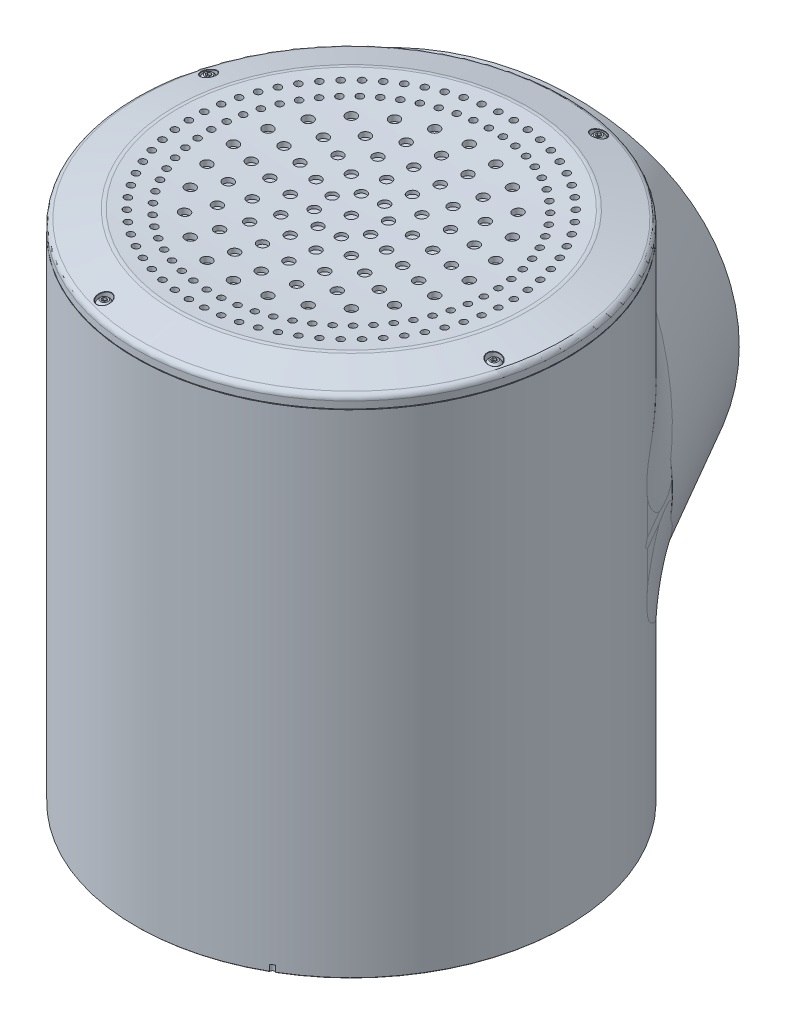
SolidWorks part; units mm, degrees
other "<4.0.07.2008582>-<输入1>"
other "<4.0.07.2008582>-<输入1>"
other "<4.0.07.2008582>-<输入1>"
other "<4.0.07.2008582>-<输入1>"
ref_plane "前视基准面" through (0, 0, 0) normal (0, 0, 1) x (1, 0, 0)
ref_plane "上视基准面" through (0, 0, 0) normal (0, 1, 0) x (1, 0, 0)
ref_plane "右视基准面" through (0, 0, 0) normal (1, 0, 0) x (0, 0, -1)
imported_body "FR20-V6.0-2-1-1-solid1"
imported_body "FR20-V6.0-2-1-1-solid2"
imported_body "FR20-V6.0-40关节后盖-1-solid1"
sketch "草图2" plane through (0, 311.2, 0) normal (0, 1, 0) x (1, 0, 0)
  circle A0 centre (0, 0) radius 93.1063
extrude "凸台-拉伸1" add sketch "草图2" along normal up to surface (10.9 mm away) contours A0
sketch "草图4" plane through (0, 326.5, 0) normal (0, 1, 0) x (1, 0, 0)
  circle A0 centre (0, 0) radius 75.45 construction
  circle A1 centre (0, 0) radius 76.25
  circle A2 centre (0, 0) radius 76.25
  circle A3 centre (0, 0) radius 75.45
  dimension "D1" = 0
extrude "凸台-拉伸2" add sketch "草图4" along normal up to surface (0.4744 mm away)
sketch "草图5" plane through (0, 322.1, 0) normal (0, 1, 0) x (1, 0, 0)
  circle A0 centre (0, 0) radius 74.3701
  circle A1 centre (0, 0) radius 63.0968
extrude "凸台-拉伸3" add sketch "草图5" along normal up to surface (4.7489 mm away)
sketch "草图6" plane through (0, 322.1, 0) normal (0, 1, 0) x (1, 0, 0)
  circle A0 centre (0, 0) radius 56.25
  circle A1 centre (0, 0) radius 45.75
extrude "凸台-拉伸4" add sketch "草图6" along normal up to surface (3.7003 mm away)
sketch "草图7" plane through (0, 322.1, 0) normal (0, 1, 0) x (1, 0, 0)
  circle A0 centre (0, 0) radius 32.7894
  circle A1 centre (0, 0) radius 21.1102
extrude "凸台-拉伸5" add sketch "草图7" along normal up to surface (2.7756 mm away)
sketch "草图8" plane through (0, 322.1, 0) normal (0, 1, 0) x (1, 0, 0)
  circle A0 centre (0, 0) radius 8.6373
extrude "凸台-拉伸6" add sketch "草图8" along normal up to surface (2.333 mm away)
sketch "草图10" plane through (0, 322.1, 0) normal (0, 1, 0) x (1, 0, 0)
  circle A0 centre (42.4264, -42.4264) radius 2.25 construction
  circle A7 centre (12.7279, -12.7279) radius 2.25 construction
  circle A8 centre (8.4853, -8.4853) radius 2.25 construction
  circle A12 centre (-8.4853, 8.4853) radius 2.25 construction
  circle A13 centre (-12.7279, 12.7279) radius 2.25 construction
  circle A16 centre (-25.4558, 25.4558) radius 2.25 construction
  circle A17 centre (-29.6985, 29.6985) radius 2.25 construction
  circle A20 centre (-42.4264, 42.4264) radius 2.25 construction
  circle A22 centre (42.4264, -42.4264) radius 2.25
  circle A29 centre (12.7279, -12.7279) radius 2.25
  circle A30 centre (8.4853, -8.4853) radius 2.25
  circle A34 centre (-8.4853, 8.4853) radius 2.25
  circle A35 centre (-12.7279, 12.7279) radius 2.25
  circle A38 centre (-25.4558, 25.4558) radius 2.25
  circle A39 centre (-29.6985, 29.6985) radius 2.25
  circle A42 centre (-42.4264, 42.4264) radius 2.25
  circle A44 centre (29.6985, -29.6985) radius 2.25 construction
  circle A45 centre (25.4558, -25.4558) radius 2.25 construction
  circle A46 centre (29.6985, -29.6985) radius 2.25
  circle A47 centre (25.4558, -25.4558) radius 2.25
extrude "凸台-拉伸7" add sketch "草图10" along normal up to surface (3.1418 mm away)
pattern_circular "阵列(圆周)1" count 6 over 360 about axis through (0, 327.6, 0) along (0, -1, 0) of "凸台-拉伸7"
inserted part "4.0.07.2008582"
move or copy body "实体-移动/复制2" placed by mates yes
inserted part "4.0.07.20085822"
move or copy body "实体-移动/复制4" placed by mates yes
inserted part "4.0.07.20085823"
move or copy body "实体-移动/复制6" placed by mates yes
inserted part "4.0.07.20085824"
move or copy body "实体-移动/复制8" placed by mates yes
sketch "草图15" plane through (0, 322.1, 0) normal (0, 1, 0) x (1, 0, 0)
  circle A0 centre (0, 0) radius 67.3214
extrude "凸台-拉伸8" add sketch "草图15" along normal up to surface (4.3063 mm away)
ref_plane "基准面5" through (0, 323.1, 0) normal (0, -1, 0) x (-1, 0, 0)
sketch "草图16" plane through (0, 323.1, 0) normal (0, -1, 0) x (-1, 0, 0)
  circle A0 centre (-1.6658, 69.9802) radius 1.5
  circle A1 centre (4.9937, 69.8216) radius 1.5
  circle A2 centre (11.6081, 69.0308) radius 1.5
  circle A3 centre (18.1173, 67.6148) radius 1.5
  circle A4 centre (24.4625, 65.5865) radius 1.5
  circle A5 centre (30.5861, 62.9642) radius 1.5
  circle A6 centre (36.4327, 59.7717) radius 1.5
  circle A7 centre (41.9494, 56.0379) radius 1.5
  circle A8 centre (47.0862, 51.7966) radius 1.5
  circle A9 centre (51.7966, 47.0862) radius 1.5
  circle A10 centre (56.0379, 41.9494) radius 1.5
  circle A11 centre (59.7717, 36.4327) radius 1.5
  circle A12 centre (62.9642, 30.5861) radius 1.5
  circle A13 centre (65.5865, 24.4625) radius 1.5
  circle A14 centre (67.6148, 18.1173) radius 1.5
  circle A15 centre (69.0308, 11.6081) radius 1.5
  circle A16 centre (69.8216, 4.9937) radius 1.5
  circle A17 centre (69.9802, -1.6658) radius 1.5
  circle A18 centre (69.505, -8.3103) radius 1.5
  circle A19 centre (68.4003, -14.8796) radius 1.5
  circle A20 centre (66.6762, -21.3141) radius 1.5
  circle A21 centre (64.3482, -27.5555) radius 1.5
  circle A22 centre (61.4375, -33.5474) radius 1.5
  circle A23 centre (57.9704, -39.2355) radius 1.5
  circle A24 centre (53.9784, -44.5683) radius 1.5
  circle A25 centre (49.4975, -49.4975) radius 1.5
  circle A26 centre (44.5683, -53.9784) radius 1.5
  circle A27 centre (39.2355, -57.9704) radius 1.5
  circle A28 centre (33.5474, -61.4375) radius 1.5
  circle A29 centre (27.5555, -64.3482) radius 1.5
  circle A30 centre (21.3141, -66.6762) radius 1.5
  circle A31 centre (14.8796, -68.4003) radius 1.5
  circle A32 centre (8.3103, -69.505) radius 1.5
  circle A33 centre (1.6658, -69.9802) radius 1.5
  circle A34 centre (-4.9937, -69.8216) radius 1.5
  circle A35 centre (-11.6081, -69.0308) radius 1.5
  circle A36 centre (-18.1173, -67.6148) radius 1.5
  circle A37 centre (-24.4625, -65.5865) radius 1.5
  circle A38 centre (-30.5861, -62.9642) radius 1.5
  circle A39 centre (-36.4327, -59.7717) radius 1.5
  circle A40 centre (-41.9494, -56.0379) radius 1.5
  circle A41 centre (-47.0862, -51.7966) radius 1.5
  circle A42 centre (-51.7966, -47.0862) radius 1.5
  circle A43 centre (-56.0379, -41.9494) radius 1.5
  circle A44 centre (-59.7717, -36.4327) radius 1.5
  circle A45 centre (-62.9642, -30.5861) radius 1.5
  circle A46 centre (-65.5865, -24.4625) radius 1.5
  circle A47 centre (-67.6148, -18.1173) radius 1.5
  circle A48 centre (-69.0308, -11.6081) radius 1.5
  circle A49 centre (-69.8216, -4.9937) radius 1.5
  circle A50 centre (-69.9802, 1.6658) radius 1.5
  circle A51 centre (-69.505, 8.3103) radius 1.5
  circle A52 centre (-68.4003, 14.8796) radius 1.5
  circle A53 centre (-66.6762, 21.3141) radius 1.5
  circle A54 centre (-64.3482, 27.5555) radius 1.5
  circle A55 centre (-61.4375, 33.5474) radius 1.5
  circle A56 centre (-57.9704, 39.2355) radius 1.5
  circle A57 centre (-53.9784, 44.5683) radius 1.5
  circle A58 centre (-49.4975, 49.4975) radius 1.5
  circle A59 centre (-44.5683, 53.9784) radius 1.5
  circle A60 centre (-39.2355, 57.9704) radius 1.5
  circle A61 centre (-33.5474, 61.4375) radius 1.5
  circle A62 centre (-27.5555, 64.3482) radius 1.5
  circle A63 centre (-21.3141, 66.6762) radius 1.5
  circle A64 centre (-14.8796, 68.4003) radius 1.5
  circle A65 centre (-8.3103, 69.505) radius 1.5
  circle A66 centre (-5.0501, 61.794) radius 1.5
  circle A67 centre (-13.4586, 50.2281) radius 2.25
  circle A68 centre (-10.8704, 40.5689) radius 2.25
  circle A69 centre (-8.2822, 30.9096) radius 2.25
  circle A70 centre (-5.694, 21.2504) radius 2.25
  circle A71 centre (-3.1058, 11.5911) radius 2.25
  circle A72 centre (1.3304, 61.9857) radius 1.5
  circle A73 centre (7.6967, 61.5204) radius 1.5
  circle A74 centre (13.9815, 60.403) radius 1.5
  circle A75 centre (20.1181, 58.6452) radius 1.5
  circle A76 centre (26.0415, 56.2658) radius 1.5
  circle A77 centre (31.6887, 53.29) radius 1.5
  circle A78 centre (37.0001, 49.7493) radius 1.5
  circle A79 centre (41.9193, 45.6812) radius 1.5
  circle A80 centre (46.3941, 41.1289) radius 1.5
  circle A81 centre (50.3771, 36.1406) radius 1.5
  circle A82 centre (53.8261, 30.7693) radius 1.5
  circle A83 centre (56.7046, 25.0717) radius 1.5
  circle A84 centre (58.9819, 19.1084) radius 1.5
  circle A85 centre (60.6341, 12.9426) radius 1.5
  circle A86 centre (61.6435, 6.6395) radius 1.5
  circle A87 centre (61.9994, 0.2661) radius 1.5
  circle A88 centre (61.6982, -6.1102) radius 1.5
  circle A89 centre (60.7429, -12.4216) radius 1.5
  circle A90 centre (59.1438, -18.6015) radius 1.5
  circle A91 centre (56.9177, -24.5841) radius 1.5
  circle A92 centre (54.0883, -30.3061) radius 1.5
  circle A93 centre (50.6855, -35.7069) radius 1.5
  circle A94 centre (46.7454, -40.7292) radius 1.5
  circle A95 centre (42.3098, -45.3197) radius 1.5
  circle A96 centre (37.4258, -49.4299) radius 1.5
  circle A97 centre (32.145, -53.016) radius 1.5
  circle A98 centre (26.5234, -56.0402) radius 1.5
  circle A99 centre (20.6208, -58.4704) radius 1.5
  circle A100 centre (14.4995, -60.2807) radius 1.5
  circle A101 centre (8.2245, -61.4521) radius 1.5
  circle A102 centre (1.8624, -61.972) radius 1.5
  circle A103 centre (-4.5195, -61.8351) radius 1.5
  circle A104 centre (-10.8535, -61.0426) radius 1.5
  circle A105 centre (-17.0725, -59.6031) radius 1.5
  circle A106 centre (-23.1104, -57.5318) radius 1.5
  circle A107 centre (-28.9034, -54.8506) radius 1.5
  circle A108 centre (-34.39, -51.588) radius 1.5
  circle A109 centre (-39.5121, -47.7786) radius 1.5
  circle A110 centre (-44.2153, -43.4627) radius 1.5
  circle A111 centre (-48.4498, -38.6861) radius 1.5
  circle A112 centre (-52.1708, -33.4994) radius 1.5
  circle A113 centre (-55.3387, -27.9576) radius 1.5
  circle A114 centre (-57.92, -22.1194) radius 1.5
  circle A115 centre (-59.8874, -16.0468) radius 1.5
  circle A116 centre (-61.2199, -9.804) radius 1.5
  circle A117 centre (-61.9035, -3.4574) radius 1.5
  circle A118 centre (-61.9309, 2.9259) radius 1.5
  circle A119 centre (-61.3018, 9.2782) radius 1.5
  circle A120 centre (-60.0229, 15.5321) radius 1.5
  circle A121 centre (-58.1078, 21.6214) radius 1.5
  circle A122 centre (-55.5767, 27.4815) radius 1.5
  circle A123 centre (-52.4564, 33.0503) radius 1.5
  circle A124 centre (-48.7801, 38.2688) radius 1.5
  circle A125 centre (-44.5867, 43.0816) radius 1.5
  circle A126 centre (-39.9207, 47.4377) radius 1.5
  circle A127 centre (-34.8316, 51.291) radius 1.5
  circle A128 centre (-29.3732, 54.6005) radius 1.5
  circle A129 centre (-23.6034, 57.3313) radius 1.5
  circle A130 centre (-17.5834, 59.4544) radius 1.5
  circle A131 centre (-11.3771, 60.9472) radius 1.5
  circle A132 centre (0, 52) radius 2.25
  circle A133 centre (13.4586, 50.2281) radius 2.25
  circle A134 centre (26, 45.0333) radius 2.25
  circle A135 centre (36.7696, 36.7696) radius 2.25
  circle A136 centre (45.0333, 26) radius 2.25
  circle A137 centre (50.2281, 13.4586) radius 2.25
  circle A138 centre (52, 0) radius 2.25
  circle A139 centre (50.2281, -13.4586) radius 2.25
  circle A140 centre (45.0333, -26) radius 2.25
  circle A141 centre (36.7696, -36.7696) radius 2.25
  circle A142 centre (26, -45.0333) radius 2.25
  circle A143 centre (13.4586, -50.2281) radius 2.25
  circle A144 centre (0, -52) radius 2.25
  circle A145 centre (-13.4586, -50.2281) radius 2.25
  circle A146 centre (-26, -45.0333) radius 2.25
  circle A147 centre (-36.7696, -36.7696) radius 2.25
  circle A148 centre (-45.0333, -26) radius 2.25
  circle A149 centre (-50.2281, -13.4586) radius 2.25
  circle A150 centre (-52, 0) radius 2.25
  circle A151 centre (-50.2281, 13.4586) radius 2.25
  circle A152 centre (-45.0333, 26) radius 2.25
  circle A153 centre (-36.7696, 36.7696) radius 2.25
  circle A154 centre (-26, 45.0333) radius 2.25
  circle A155 centre (2.1981, 41.9424) radius 2.25
  circle A156 centre (15.0515, 39.2104) radius 2.25
  circle A157 centre (26.4315, 32.6401) radius 2.25
  circle A158 centre (35.2242, 22.8748) radius 2.25
  circle A159 centre (40.5689, 10.8704) radius 2.25
  circle A160 centre (41.9424, -2.1981) radius 2.25
  circle A161 centre (39.2104, -15.0515) radius 2.25
  circle A162 centre (32.6401, -26.4315) radius 2.25
  circle A163 centre (22.8748, -35.2242) radius 2.25
  circle A164 centre (10.8704, -40.5689) radius 2.25
  circle A165 centre (-2.1981, -41.9424) radius 2.25
  circle A166 centre (-15.0515, -39.2104) radius 2.25
  circle A167 centre (-26.4315, -32.6401) radius 2.25
  circle A168 centre (-35.2242, -22.8748) radius 2.25
  circle A169 centre (-40.5689, -10.8704) radius 2.25
  circle A170 centre (-41.9424, 2.1981) radius 2.25
  circle A171 centre (-39.2104, 15.0515) radius 2.25
  circle A172 centre (-32.6401, 26.4315) radius 2.25
  circle A173 centre (-22.8748, 35.2242) radius 2.25
  circle A174 centre (4.1768, 31.7262) radius 2.25
  circle A175 centre (16, 27.7128) radius 2.25
  circle A176 centre (25.3873, 19.4804) radius 2.25
  circle A177 centre (30.9096, 8.2822) radius 2.25
  circle A178 centre (31.7262, -4.1768) radius 2.25
  circle A179 centre (27.7128, -16) radius 2.25
  circle A180 centre (19.4804, -25.3873) radius 2.25
  circle A181 centre (8.2822, -30.9096) radius 2.25
  circle A182 centre (-4.1768, -31.7262) radius 2.25
  circle A183 centre (-16, -27.7128) radius 2.25
  circle A184 centre (-25.3873, -19.4804) radius 2.25
  circle A185 centre (-30.9096, -8.2822) radius 2.25
  circle A186 centre (-31.7262, 4.1768) radius 2.25
  circle A187 centre (-27.7128, 16) radius 2.25
  circle A188 centre (-19.4804, 25.3873) radius 2.25
  circle A189 centre (5.694, 21.2504) radius 2.25
  circle A190 centre (15.5563, 15.5563) radius 2.25
  circle A191 centre (21.2504, 5.694) radius 2.25
  circle A192 centre (21.2504, -5.694) radius 2.25
  circle A193 centre (15.5563, -15.5563) radius 2.25
  circle A194 centre (5.694, -21.2504) radius 2.25
  circle A195 centre (-5.694, -21.2504) radius 2.25
  circle A196 centre (-15.5563, -15.5563) radius 2.25
  circle A197 centre (-21.2504, -5.694) radius 2.25
  circle A198 centre (-21.2504, 5.694) radius 2.25
  circle A199 centre (-15.5563, 15.5563) radius 2.25
  circle A200 centre (6, 10.3923) radius 2.25
  circle A201 centre (11.5911, 3.1058) radius 2.25
  circle A202 centre (10.3923, -6) radius 2.25
  circle A203 centre (3.1058, -11.5911) radius 2.25
  circle A204 centre (-6, -10.3923) radius 2.25
  circle A205 centre (-11.5911, -3.1058) radius 2.25
  circle A206 centre (-10.3923, 6) radius 2.25
  circle A207 centre (0, 0) radius 2.25
  point P134 (0, 0)
  point P267 (0, 0)
  point P314 (0, 0)
  point P353 (0, 0)
  point P384 (0, 0)
  point P407 (0, 0)
  point P422 (0, 0)
  dimension "D1" = 66
  dimension "D2" = 61
  dimension "D3" = 24
  dimension "D4" = 20
  dimension "D5" = 16
  dimension "D6" = 12
  dimension "D7" = 8
extrude "切除-拉伸1" cut sketch "草图16" against normal blind 10
